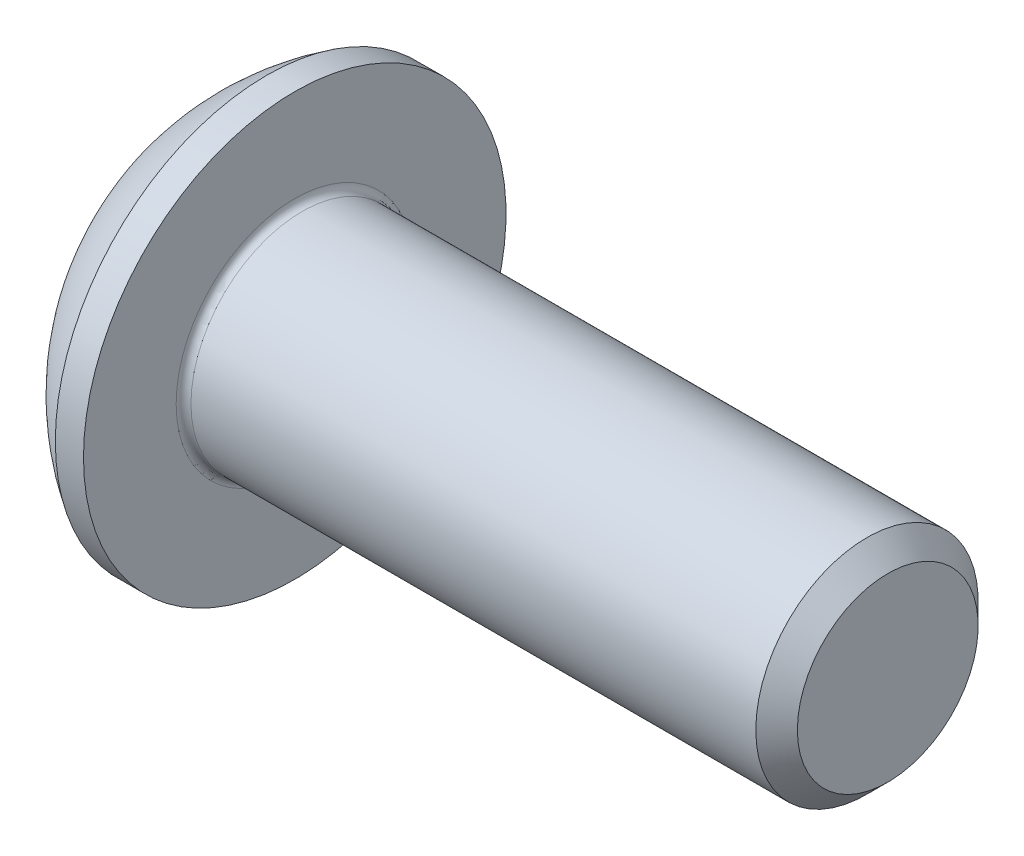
SolidWorks part; units mm, degrees
ref_plane "Plane1" through (0, 0, 0) normal (0, 0, 1) x (1, 0, 0)
ref_plane "Plane2" through (0, 0, 0) normal (0, 1, 0) x (1, 0, 0)
ref_plane "Plane3" through (0, 0, 0) normal (1, 0, 0) x (0, 0, -1)
other "Configuration Table"
sketch "BodySke" plane through (0, 0, 0) normal (0, 0, 1) x (1, 0, 0)
  line L0 (9.65, 0) -> (9.65, 1.2195)
  line L1 (9.3695, 1.5) -> (1.65, 1.5)
  line L2 (1.65, 1.5) -> (1.65, 2.85)
  line L3 (1.65, 2.85) -> (1.27, 2.85)
  line L4 (0, 0) -> (101.6, 0) construction
  line L5 (1.65, -2.85) -> (1.27, -2.85) construction
  line L6 (55.6768, -1.5) -> (1.65, -1.5) construction
  line L7 (9.65, 0) -> (0, 0)
  line L8 (0, 1.425) -> (0, -1.425) construction
  line L9 (0, 0) -> (0, 1.425)
  line L10 (9.65, 1.2195) -> (9.3695, 1.5)
  line L11 (9.65, -1.2195) -> (9.3695, -1.5) construction
  line L12 (2.15, 9.525) -> (2.15, -1.5) construction
  line L13 (1.65, 9.525) -> (1.65, -1.5) construction
  arc A1 (0, 1.425) -> (1.27, 2.85) centre (3.0334, 0) cw
revolve "BaseBody" add sketch "BodySke" angle 360 about L4
fillet "Fillet1" radius 0.1 1 edges at (1.65, 0, 1.5)
sketch "Sketch2" plane through (0, 0, 0) normal (0, 0, 1) x (1, 0, 0)
  line L0 (0, 1) -> (1.04, 1)
  line L1 (1.04, 1) -> (1.6174, 0)
  line L3 (1.6174, 0) -> (0, 0)
  line L4 (0, 0) -> (0, 1)
  line L5 (0, -1) -> (1.04, -1) construction
  line L6 (0, 0) -> (47.625, 0) construction
  dimension "D2" = 60
  dimension "PreBroach_depth" = 1.04
  dimension "PreBroach_dia" = 2
revolve "PreBroach" cut sketch "Sketch2" angle 360 about L6
sketch "Sketch3" plane through (0, 0, 0) normal (1, 0, 0) x (0, 0, -1)
  line L0 (-1, -0.5774) -> (-1, 0.5774)
  line L1 (-1, 0.5774) -> (0, 1.1547)
  line L2 (0, 1.1547) -> (1, 0.5774)
  line L3 (1, 0.5774) -> (1, -0.5774)
  line L4 (1, -0.5774) -> (0, -1.1547)
  line L5 (0, -1.1547) -> (-1, -0.5774)
extrude "Hex" cut sketch "Sketch3" along normal blind 1.04
sketch "ThdSchSke" plane through (0, 0, 0) normal (0, 0, 1) x (1, 0, 0)
  line L0 (2.65, -1.2195) -> (2.4536, -1.5)
  line L1 (2.65, -1.2195) -> (2.8464, -1.5)
  line L2 (2.8464, -1.5) -> (2.8464, -1.875)
  line L3 (-3.175, 0) -> (5.1513, 0) construction
  line L5 (2.8464, -1.875) -> (2.4536, -1.875)
  line L6 (2.4536, -1.875) -> (2.4536, -1.5)
revolve "ThreadSchematic" [suppressed] cut sketch "ThdSchSke" angle 360 about L3
pattern_linear "ThdSchPat" [suppressed]
equation "\"D1@BodySke\" = \"Head_dia@BodySke\" * .5"
equation "\"Thread_minor@ThreadCosmetic\" = \"Minor_dia@BodySke\""
equation "\"D1@Sketch3\" = \"Hex_size@Sketch3\" / 2"
equation "\"D2@Sketch3\" = \"D1@Sketch3\""
equation "\"D3@Sketch3\" = \"Hex_size@Sketch3\""
equation "\"Thread_length@ThreadCosmetic\" = ((sgn( (\"Length@BodySke\" - \"Advance@BodySke\" * 2.0) - \"Thread_nom@BodySke\" )-1)*( (\"Length@BodySke\" - \"Advance@BodySke\" * 2.0) - \"Thread_nom@BodySke\" ))/-2+ \"Thread_no"
equation "\"Thread_minor@ThdSchSke\" = \"Minor_dia@BodySke\""
equation "\"Diameter@ThdSchSke\" = \"Diameter@BodySke\""
equation "\"Overcut@ThdSchSke\" = \"Diameter@BodySke\" * 1.25"
equation "\"Start@ThdSchSke\" = \"Head_ht@BodySke\" + \"Length@BodySke\" - \"Thread_length@ThreadCosmetic\"  '---Non-countersunk---"
equation "\"Num_threads@ThdSchPat\" = int( \"Thread_length@ThreadCosmetic\" / \"Advance@BodySke\" + 0.999 )  + 1"
equation "\"Advance@ThdSchPat\" = \"Thread_length@ThreadCosmetic\" /  (\"Num_threads@ThdSchPat\" - 1) 'relax it"
equation "\"Num_threads@ThdSchPat\" = \"Num_threads@ThdSchPat\" - sgn( \"Num_threads@ThdSchPat\" - 1) '---chamfered tips only---"
